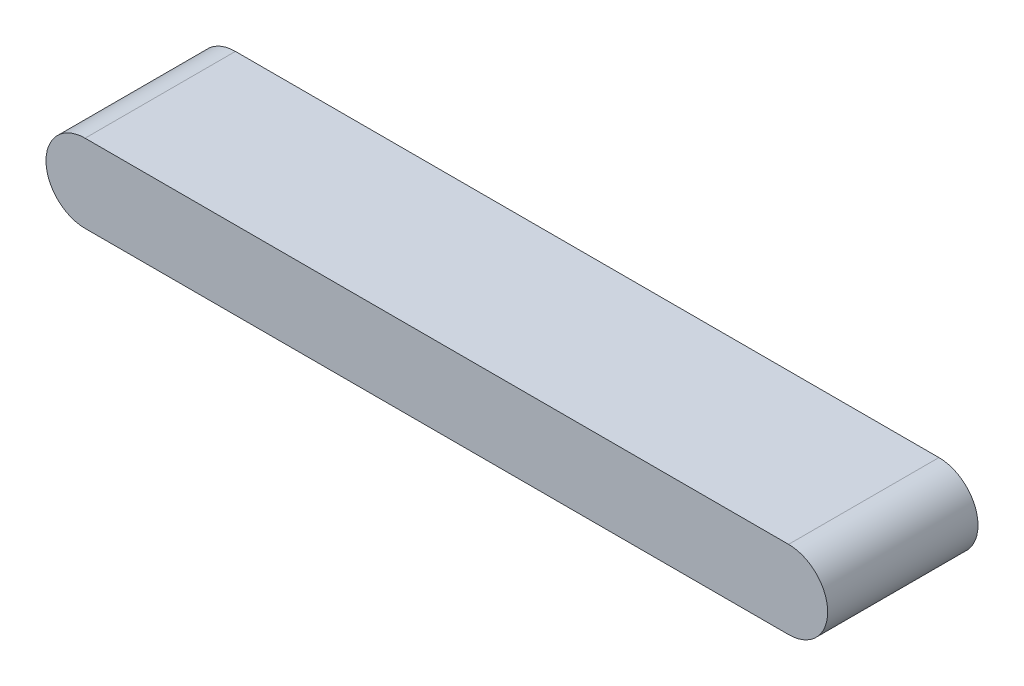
SolidWorks part; units mm, degrees
ref_plane "Front Plane" through (0, 0, 0) normal (0, 0, 1) x (1, 0, 0)
ref_plane "Top Plane" through (0, 0, 0) normal (0, 1, 0) x (1, 0, 0)
ref_plane "Right Plane" through (0, 0, 0) normal (1, 0, 0) x (0, 0, -1)
sketch "Sketch1" plane through (0, 0, 0) normal (0, 0, 1) x (1, 0, 0)
  line L0 (0, 16.51) -> (297.18, 16.51)
  line L1 (0, -16.51) -> (297.18, -16.51)
  arc A0 (0, 16.51) -> (0, -16.51) centre (0, 0) ccw
  circle A1 centre (33.02, 0) radius 16.51 construction
  circle A2 centre (66.04, 0) radius 16.51 construction
  circle A3 centre (99.06, 0) radius 16.51 construction
  circle A4 centre (132.08, 0) radius 16.51 construction
  circle A5 centre (165.1, 0) radius 16.51 construction
  circle A6 centre (198.12, 0) radius 16.51 construction
  circle A7 centre (231.14, 0) radius 16.51 construction
  circle A8 centre (264.16, 0) radius 16.51 construction
  arc A9 (297.18, -16.51) -> (297.18, 16.51) centre (297.18, 0) ccw
  dimension "D1" = 33.02
  dimension "D2" = 10
extrude "Boss-Extrude1" add sketch "Sketch1" along normal blind 63.5
